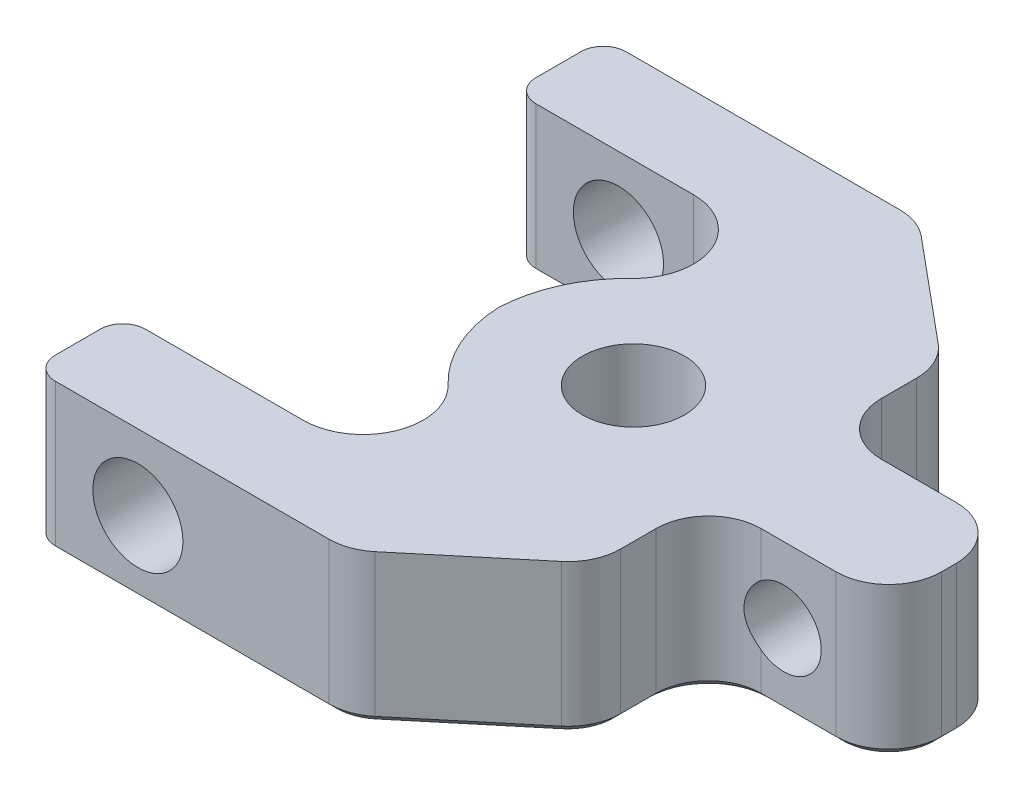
SolidWorks part; units mm, degrees
ref_plane "Plan de face" through (0, 0, 0) normal (0, 0, 1) x (1, 0, 0)
ref_plane "Plan de dessus" through (0, 0, 0) normal (0, 1, 0) x (1, 0, 0)
ref_plane "Plan de droite" through (0, 0, 0) normal (1, 0, 0) x (0, 0, -1)
sketch "Esquisse1" plane through (0, 0, 0) normal (0, 0, 1) x (1, 0, 0)
  line L1 (21, 0) -> (-21, 0)
  line L2 (-21, 0) -> (-21, -10)
  line L4 (-21, -10) -> (21, -10)
  line L5 (21, -10) -> (21, 0)
  dimension "D1" = 10
  dimension "D2" = 21
  dimension "D3" = 42
extrude "Boss.-Extru.2" add sketch "Esquisse1" along normal mid plane 38
sketch "Esquisse13" plane through (0, 0, 0) normal (0, 1, 0) x (1, 0, 0)
  line L1 (-21, -19) -> (-21, 19) construction
  line L2 (-21, 13) -> (-9, 13)
  line L3 (-21, 13) -> (-21, -13)
  line L4 (-21, -13) -> (-9, -13)
  line L8 (-9, 13) -> (-9, -13)
  line L9 (21, 19) -> (9, 19)
  line L10 (21, 19) -> (21, 4)
  line L11 (21, 4) -> (9, 4)
  line L12 (9, 11.5) -> (9, 4)
  line L13 (21, -19) -> (9, -19)
  line L14 (21, -19) -> (21, -4)
  line L15 (21, -4) -> (9, -4)
  line L19 (9, -11.5) -> (9, -4)
  line L20 (21, 19) -> (-21, 19) construction
  line L21 (21, -19) -> (-21, -19) construction
  line L22 (9, 11.5) -> (0, 19)
  line L23 (9, -11.5) -> (0, -19)
  line L24 (0, -19) -> (9, -19)
  line L25 (9, 19) -> (0, 19)
  dimension "D1" = 12
  dimension "D2" = 6
  dimension "D3" = 12
  dimension "D4" = 6
  dimension "D5" = 8
  dimension "D6" = 12
  dimension "D7" = 4
  dimension "D8" = 7.5
  dimension "D9" = 12
  dimension "D10" = 7.5
  dimension "D11" = 12
extrude "Enlèv. mat.-Extru.3" cut sketch "Esquisse13" against normal through all
sketch "Esquisse4" plane through (0, 0, 0) normal (0, 0, 1) x (1, 0, 0)
  circle A0 centre (-14, -5) radius 3
  dimension "D2" = 14
  dimension "D3" = 6
  dimension "D1" = 5
extrude "Enlèv. mat.-Extru.2" cut sketch "Esquisse4" against normal mid plane 44
hole_wizard "Trou taraudé M81" positions "Esquisse15" profile "Esquisse14" tap size "M8" standard "ISO"
sketch "Esquisse15" plane through (0, 0, 0) normal (0, 1, 0) x (-1, 0, 0)
  point P0 (0, 0)
sketch "Esquisse14" plane through (0, 0, 0) normal (1, 0, 0) x (0, 0, 1)
  line L0 (0, 0) -> (0, 21.7929)
  line L1 (0, 21.7929) -> (3.4, 19.75)
  line L2 (3.4, 19.75) -> (3.4, 0)
  line L5 (3.4, 0) -> (0, 0)
  line L10 (0, 21.7929) -> (-3.4, 19.75) construction
  line L11 (0, -6.35) -> (0, 107.95) construction
  dimension "Diamètre du trou pour taraudage" = 6.8
  dimension "Profondeur du trou pour taraudage" = 19.75
  dimension "Angle de pointe" = 118
fillet "Congé1" radius 3.5 8 edges at (9, -5, -4) (0, -5, -19) (9, -5, -11.5) (0, -5, 19) (9, -5, 11.5) (9, -5, 4) (21, -5, -4) (21, -5, 4)
hole_wizard "Trou taraudé M61" positions "Esquisse8" profile "Esquisse7" tap size "M6" standard "ISO"
sketch "Esquisse8" plane through (0, 0, 19) normal (0, 0, 1) x (1, 0, 0)
  line L2 (-1.2672, 0) -> (-21, 0) construction
  point P0 (14, -5)
  dimension "D1" = 5
  dimension "D2" = 14
sketch "Esquisse7" plane through (14, -5, 19) normal (1, 0, 0) x (0, -1, 0)
  line L0 (0, 0) -> (0, 38)
  line L1 (0, 38) -> (2.5, 38)
  line L2 (2.5, 38) -> (2.5, 0)
  line L5 (2.5, 0) -> (0, 0)
  line L11 (0, -6.35) -> (0, 107.95) construction
  dimension "Diamètre du trou pour taraudage jusqu'au prochain" = 5
  dimension "Profondeur du trou pour taraudage jusqu'au prochain" = 38
fillet "Congé2" radius 1.5 4 edges at (-21, -5, 19) (-21, -5, 13) (-21, -5, -13) (-21, -5, -19)
sketch "Esquisse16" plane through (0, 0, 0) normal (0, 1, 0) x (1, 0, 0)
  line L0 (-9, -13) -> (-9, 13) construction
  line L1 (-9, 13) -> (-19.5, 13) construction
  line L2 (-19.5, -13) -> (-9, -13) construction
  circle A0 centre (-9, 9) radius 4
  circle A1 centre (-9, -9) radius 4
  dimension "D1" = 8
extrude "Enlèv. mat.-Extru.4" cut sketch "Esquisse16" against normal through all
fillet "Congé3" radius 9 2 edges at (-9, -5, 5) (-9, -5, -5)
chamfer "Chanfrein1" distance 0.5 angle 45 29 edges at (-14.25, -10, -13) (-20.5607, -10, -13.4393) (-21, -10, -16) (-20.5607, -10, -18.5607) (-10.3836, -10, -19) (-0.0757, -10, -18.791) (4.3571, -10, -15.3691) (8.6696, -10, -11.3452) (9, -10, -8.6803) (10.0251, -10, -5.0251) (15, -10, -4) (19.9749, -10, -2.9749) (21, -10, 0) (19.9749, -10, 2.9749) (15, -10, 4) (10.0251, -10, 5.0251) (9, -10, 8.6803) (8.6696, -10, 11.3452) (4.3571, -10, 15.3691) (-0.0757, -10, 18.791) (-10.3836, -10, 19) (-20.5607, -10, 18.5607) (-21, -10, 16) (-20.5607, -10, 13.4393) (-14.25, -10, 13) (-8.2022, -10, -3.3237) (-5.2888, -10, -10.4924) (-8.2022, -10, 3.3237) (-5.2888, -10, 10.4924)
